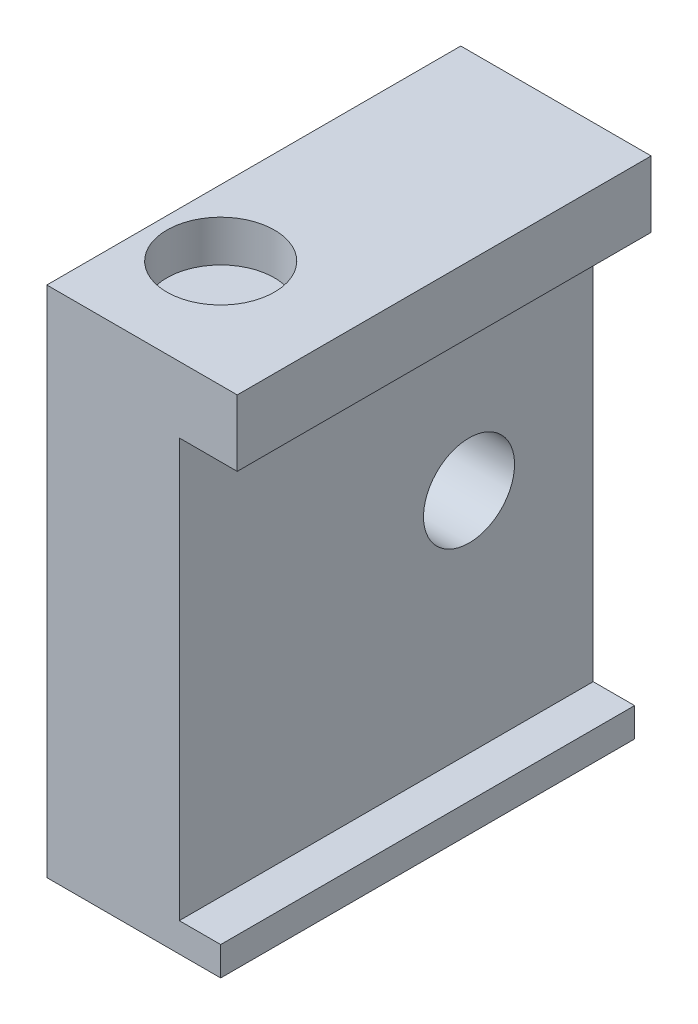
SolidWorks part; units mm, degrees
ref_plane "Plan de face" through (0, 0, 0) normal (0, 0, 1) x (1, 0, 0)
ref_plane "Plan de dessus" through (0, 0, 0) normal (0, 1, 0) x (1, 0, 0)
ref_plane "Plan de droite" through (0, 0, 0) normal (1, 0, 0) x (0, 0, -1)
mirrored part "190.003.089 support ventouse_Rendre symétrique"
other "<190.003.089 support ventouse>-<Enlèv. mat.-Extru.2>"
